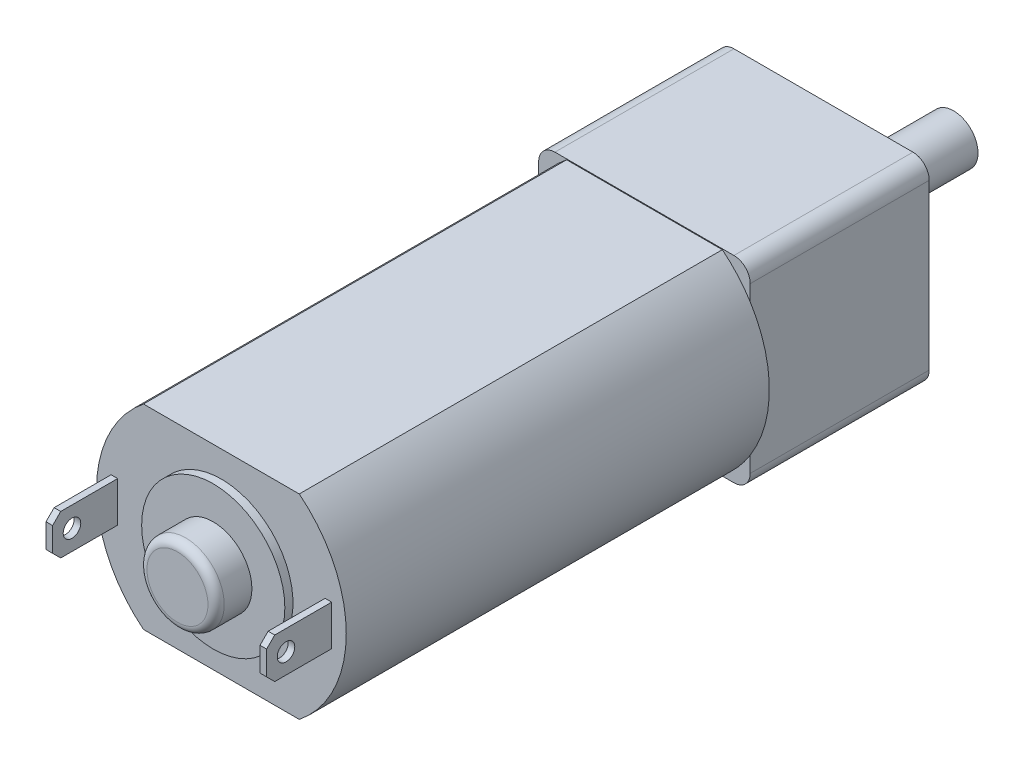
SolidWorks part; units mm, degrees
ref_plane "Front Plane" through (0, 0, 0) normal (0, 0, 1) x (1, 0, 0)
ref_plane "Top Plane" through (0, 0, 0) normal (0, 1, 0) x (1, 0, 0)
ref_plane "Right Plane" through (0, 0, 0) normal (1, 0, 0) x (0, 0, -1)
imported_body "Imported1"
sketch "Sketch1" plane through (0, 0, 26) normal (0, 0, 1) x (1, 0, 0)
  circle A0 centre (0, 0) radius 7.675
  dimension "D1" = 15.35
extrude "Boss-Extrude1" add sketch "Sketch1" against normal blind 26
sketch "Sketch2" plane through (0, 0, 26) normal (0, 0, 1) x (1, 0, 0)
  line L9 (-4.786, -6) -> (4.786, -6)
  line L10 (-4.786, -6) -> (-4.786, 6)
  line L11 (-4.786, 6) -> (4.786, 6)
  line L12 (4.786, -6) -> (4.786, 6)
  line L13 (-4.786, -6) -> (4.786, 6) construction
  line L14 (-4.786, 6) -> (4.786, -6) construction
  circle A3 centre (0, 0) radius 7.675
  circle A4 centre (0, 0) radius 7.675 construction
  point P0 (0, 0)
  dimension "D1" = 12
extrude "Cut-Extrude1" cut sketch "Sketch2" against normal blind 26 contours L11 M25 | L9 M25
sketch "Sketch4" plane through (0, 0, -22.7) normal (0, 0, -1) x (-1, 0, 0)
  circle A0 centre (0, 0) radius 1.8808
extrude "Cut-Extrude2" cut sketch "Sketch4" against normal blind 3.7
